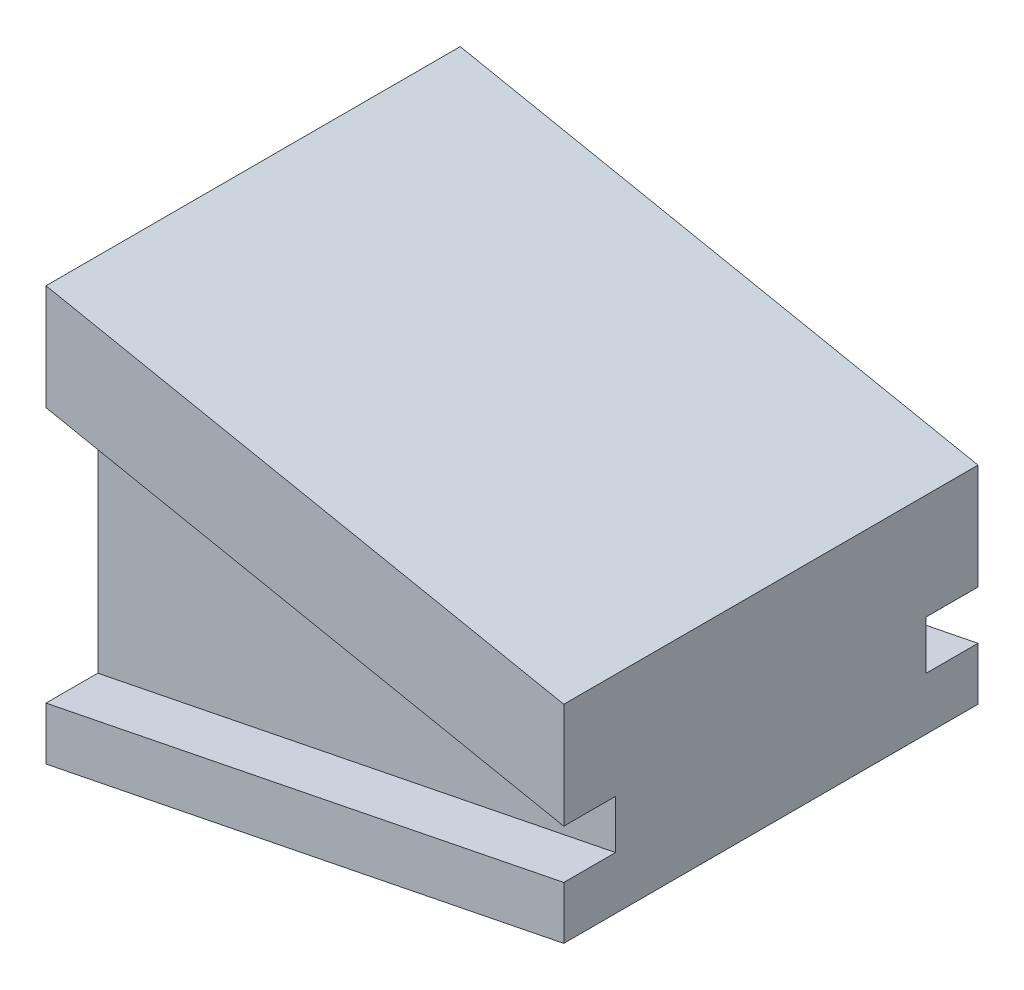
SolidWorks part; units mm, degrees
ref_plane "Front Plane" through (0, 0, 0) normal (0, 0, 1) x (1, 0, 0)
ref_plane "Top Plane" through (0, 0, 0) normal (0, 1, 0) x (1, 0, 0)
ref_plane "Right Plane" through (0, 0, 0) normal (1, 0, 0) x (0, 0, -1)
sketch "Sketch1" plane through (0, 0, 0) normal (0, 0, 1) x (1, 0, 0)
  line L0 (0, 0) -> (0, 20)
  line L1 (0, 0) -> (-50, -10)
  line L2 (-50, -10) -> (-50, 30)
  line L3 (-50, 30) -> (0, 20)
  line L4 (0, 10) -> (-50, 10) construction
  dimension "D1" = 50
  dimension "D2" = 20
  dimension "D3" = 40
extrude "Boss-Extrude1" add sketch "Sketch1" along normal blind 40
ref_plane "Plane1" through (0, 0, 20) normal (0, 0, 1) x (1, 0, 0)
sketch "Sketch5" plane through (0, 0, 40) normal (0, 0, 1) x (1, 0, 0)
  line L5 (0, 20) -> (-50, 30) construction
  line L6 (0, 9.802) -> (-50, 19.802)
  line L7 (0, 0) -> (0, 20) construction
  line L8 (-50, 30) -> (-50, -10) construction
  line L9 (-50, 19.802) -> (-50, -4.901)
  line L10 (-50, -4.901) -> (0, 5.099)
  line L12 (0, 5.099) -> (0, 9.802)
  line L14 (-50, -4.901) -> (-50, -10) construction
  line L15 (-50, -10) -> (0, 0) construction
  dimension "D1" = 5
  dimension "D2" = 10
extrude "Cut-Extrude1" cut sketch "Sketch5" against normal blind 5 and the other way through all
mirror "Mirror1" about plane through (0, 0, 20) normal (0, 0, 1) of "Cut-Extrude1"
